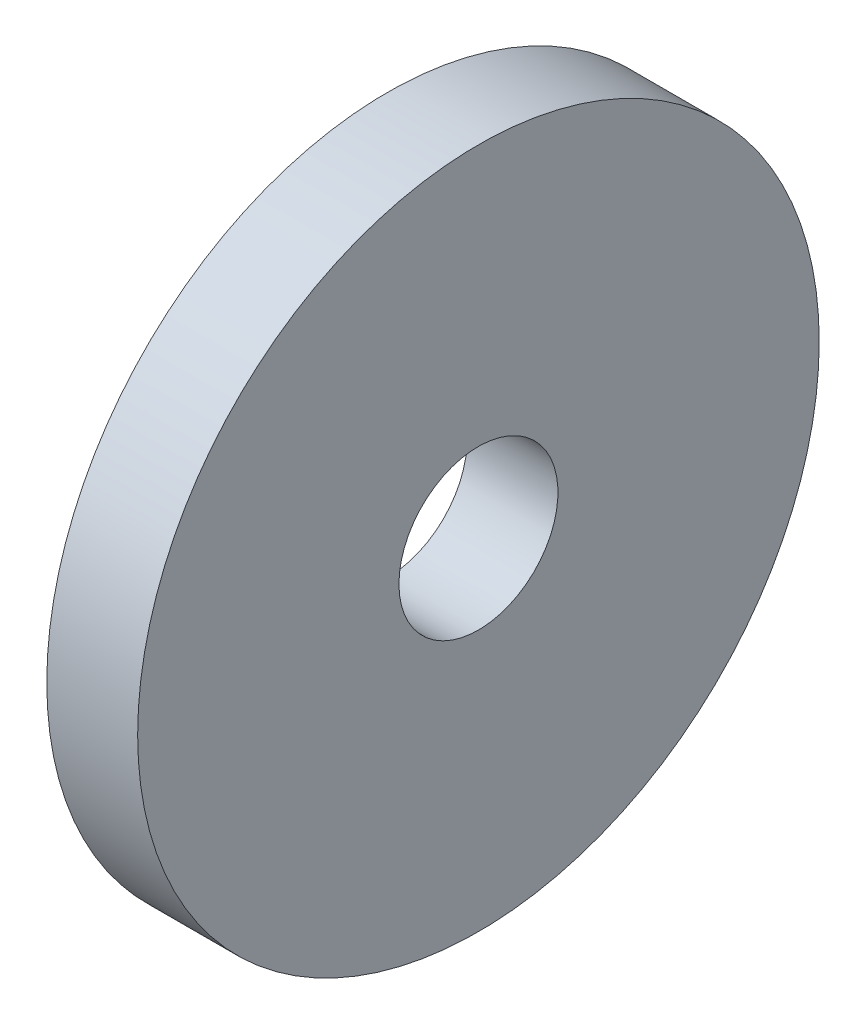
SolidWorks part; units mm, degrees
ref_plane "Plan1" through (0, 0, 0) normal (0, 0, 1) x (1, 0, 0)
ref_plane "Plan2" through (0, 0, 0) normal (0, 1, 0) x (1, 0, 0)
ref_plane "Plan3" through (0, 0, 0) normal (1, 0, 0) x (0, 0, -1)
sketch "Esquisse1" plane through (0, 0, 0) normal (0, 0, 1) x (1, 0, 0)
  line L0 (0, 4) -> (0, 15.5)
  line L4 (4, 15.5) -> (4, 4)
  line L8 (-12.5747, 0.5) -> (48.4041, 0.5) construction
  line L9 (0, 15.5) -> (4, 15.5)
  line L10 (4, 4) -> (0, 4)
  dimension "D1" = 4
  dimension "D2" = 15
  dimension "D3" = 3.5
revolve "Base-Révolution" add sketch "Esquisse1" angle 360 about L8
